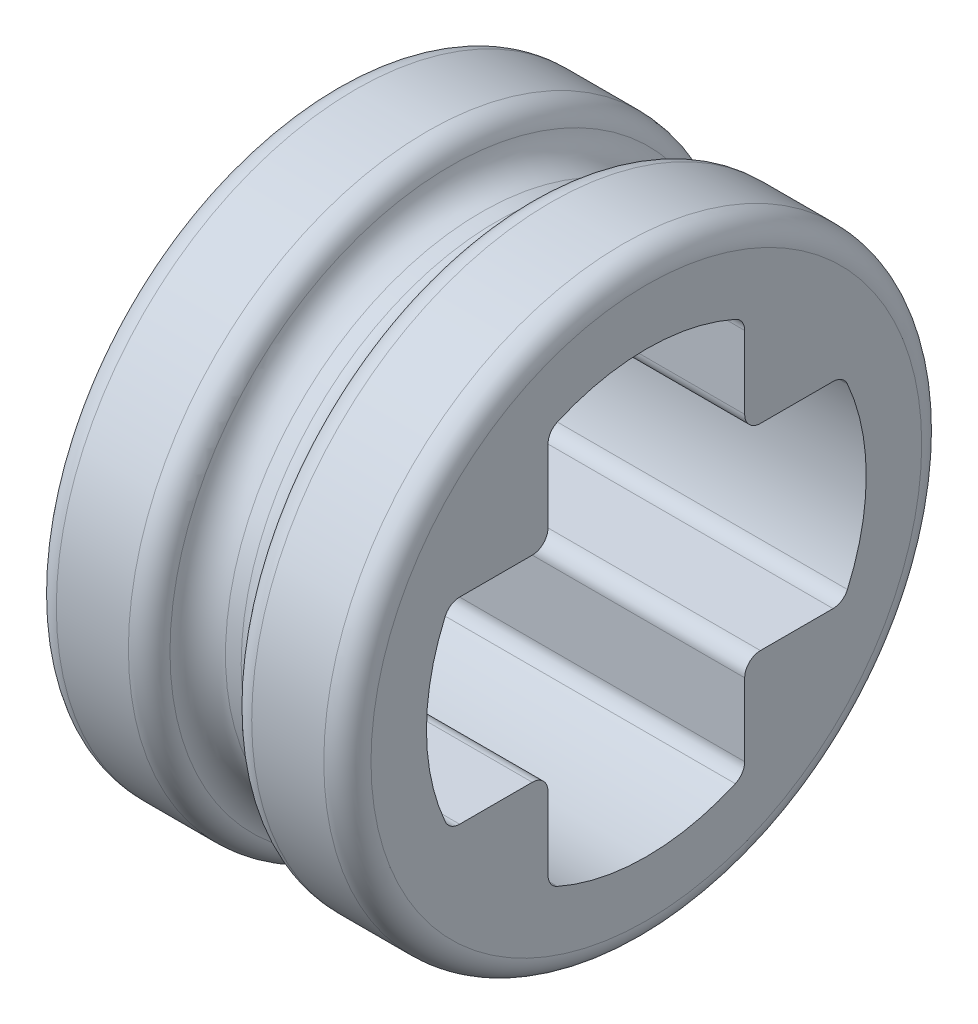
SolidWorks part; units mm, degrees
ref_plane "Front Plane" through (0, 0, 0) normal (0, 0, 1) x (1, 0, 0)
ref_plane "Top Plane" through (0, 0, 0) normal (0, 1, 0) x (1, 0, 0)
ref_plane "Right Plane" through (0, 0, 0) normal (1, 0, 0) x (0, 0, -1)
sketch "Sketch1" plane through (0, 0, 0) normal (0, 0, 1) x (1, 0, 0)
  line L0 (2, 0) -> (-2, 0)
  line L1 (-2, 0) -> (-2, 3.8)
  line L2 (-2, 3.8) -> (-0.5, 3.8)
  line L3 (-0.5, 3.8) -> (-0.5, 3.25)
  line L4 (0, -4.18) -> (0, 4.18) construction
  line L5 (0.5, 3.8) -> (0.5, 3.25)
  line L6 (2, 3.8) -> (0.5, 3.8)
  line L7 (2, 0) -> (2, 3.8)
  line L8 (-0.5, 3.25) -> (0.5, 3.25)
  point P9 (0, 0)
  dimension "D1" = 1.5
  dimension "D2" = 4
  dimension "D3" = 3.25
  dimension "D4" = 3.8
revolve "Revolve1" add sketch "Sketch1" angle 360 about L0
fillet "Fillet1" radius 0.4 2 edges at (0.5, 0, -3.25) (-0.5, 0, -3.25)
sketch "Sketch2" plane through (-2, 0, 0) normal (-1, 0, 0) x (0, 0, 1)
  line L0 (0, 3.8) -> (0, -3.8) construction
  line L2 (-1.25, 2.5) -> (-1.25, 1.25)
  line L4 (1.25, 2.5) -> (1.25, 1.25)
  line L5 (-2.5, 1.25) -> (-1.25, 1.25)
  line L7 (-2.5, -1.25) -> (-1.25, -1.25)
  line L9 (-3.8, 0) -> (3.8, 0) construction
  line L10 (1.25, -1.25) -> (1.25, -2.5)
  line L11 (1.25, 1.25) -> (2.5, 1.25)
  line L12 (-1.25, -1.25) -> (-1.25, -2.5)
  line L13 (1.25, -1.25) -> (2.5, -1.25)
  circle A0 centre (0, 0) radius 3.8 construction
  arc A1 (-2.5, 1.25) -> (-2.5, -1.25) centre (0, 0) ccw
  arc A2 (-1.25, -2.5) -> (1.25, -2.5) centre (0, 0) ccw
  arc A3 (2.5, -1.25) -> (2.5, 1.25) centre (0, 0) ccw
  arc A4 (1.25, 2.5) -> (-1.25, 2.5) centre (0, 0) ccw
  dimension "D1" = 2.5
  dimension "D3" = 5
  dimension "D4" = 5
extrude "Cut-Extrude1" cut sketch "Sketch2" against normal through all
fillet "Fillet2" radius 0.2 12 edges at (0, 1.25, -1.25) (0, 2.5, -1.25) (0, 1.25, -2.5) (0, -1.25, -2.5) (0, -1.25, -1.25) (0, -2.5, -1.25) (0, -2.5, 1.25) (0, -1.25, 1.25) (0, 1.25, 1.25) (0, 2.5, 1.25) (0, -1.25, 2.5) (0, 1.25, 2.5)
fillet "Fillet3" radius 0.3 4 edges at (2, 0, -3.8) (0.5, 0, -3.8) (-0.5, 0, -3.8) (-2, 0, -3.8)
sketch "Sketch3" plane through (-2, 0, 0) normal (-1, 0, 0) x (0, 0, 1)
  circle A0 centre (0, 0) radius 2.8
  dimension "D1" = 5.6
extrude "Cut-Extrude2" cut sketch "Sketch3" against normal blind 0.05
